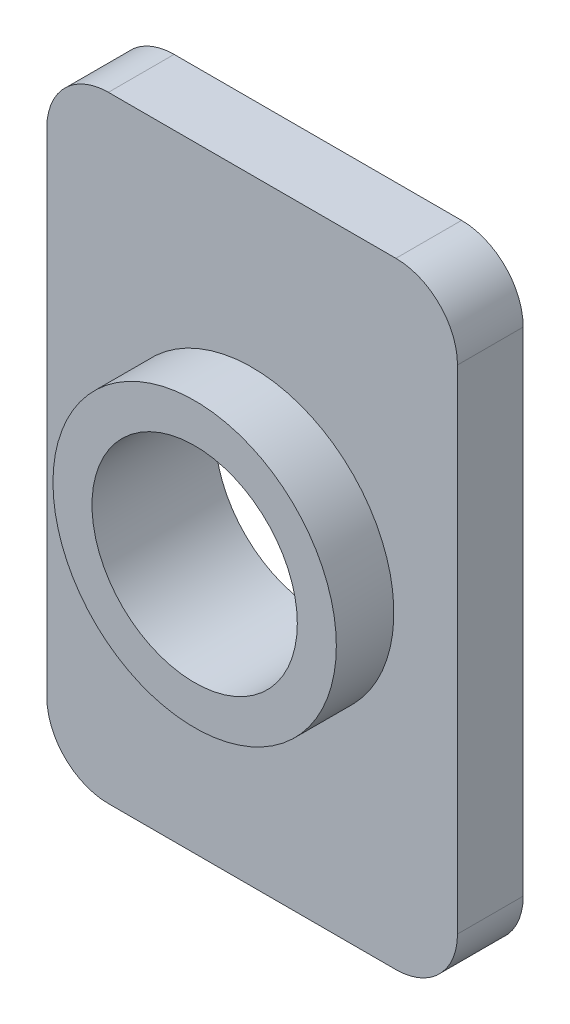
SolidWorks part; units mm, degrees
ref_plane "Front Plane" through (0, 0, 0) normal (0, 0, 1) x (1, 0, 0)
ref_plane "Top Plane" through (0, 0, 0) normal (0, 1, 0) x (1, 0, 0)
ref_plane "Right Plane" through (0, 0, 0) normal (1, 0, 0) x (0, 0, -1)
ref_plane "Plane1"
sketch "Sketch1" plane through (0, 0, 0) normal (0, 0, 1) x (1, 0, 0)
  line L0 (-5, 7.5) -> (5, 7.5)
  line L1 (5, 7.5) -> (5, -7.5)
  line L2 (5, -7.5) -> (-5, -7.5)
  line L3 (-5, -7.5) -> (-5, 7.5)
  dimension "D1" = 10
  dimension "D2" = 15
extrude "Extrusion1" add sketch "Sketch1" along normal blind 1.6
sketch "Sketch2" plane through (0, 0, 1.6) normal (0, 0, 1) x (1, 0, 0)
  circle A0 centre (0, 0) radius 3.45
  dimension "D1" = 6.9
extrude "Extrusion2" add sketch "Sketch2" along normal blind 1.4
hole_wizard "Hole1" positions "Sketch4" profile "Sketch3" legacy
sketch "Sketch4" plane through (0, 0, 3) normal (0, 0, 1) x (1, 0, 0)
  point P1 (0, 0)
sketch "Sketch3" plane through (0, 0, 3) normal (1, 0, 0) x (0, -1, 0)
  line L0 (0, 0) -> (0, 3)
  line L1 (0, 3) -> (2.5, 3)
  line L2 (2.5, 3) -> (2.5, 0)
  line L3 (2.5, 0) -> (0, 0)
  line L4 (0, 110) -> (0, -10) construction
  dimension "Diameter" = 5
  dimension "Depth" = 3
fillet "Fillet1" radius 1.5 4 edges at (-5, -7.5, 0.8) (5, -7.5, 0.8) (-5, 7.5, 0.8) (5, 7.5, 0.8)
ref_plane "Plane2" through (0, 0, 0) normal (1, 0, 0) x (0, 0, -1)
